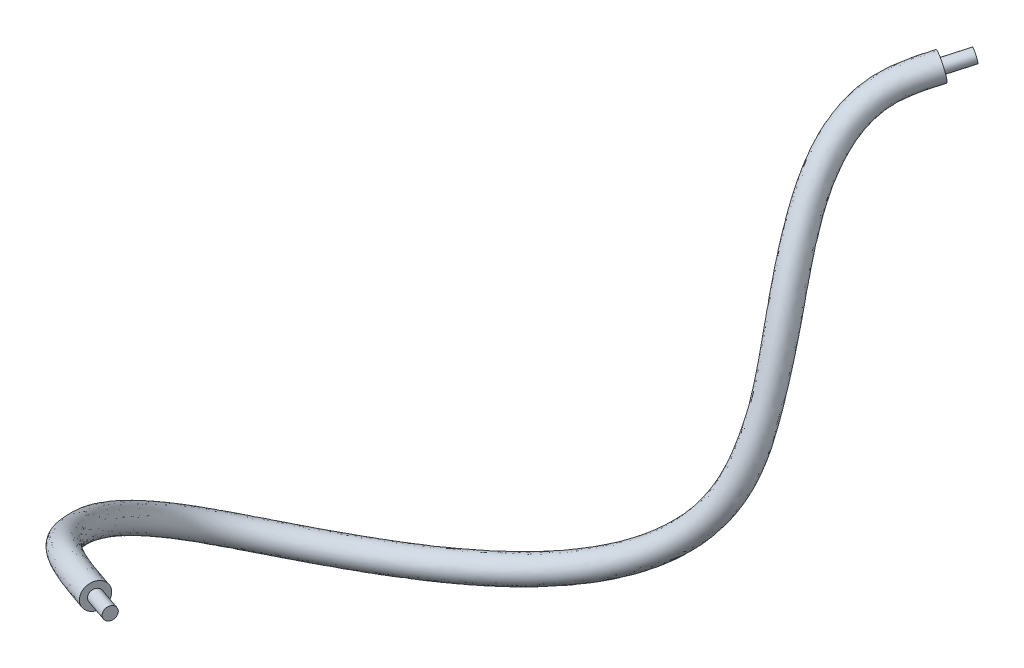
SolidWorks part; units mm, degrees
ref_plane "Plan de face" through (0, 0, 0) normal (0, 0, 1) x (1, 0, 0)
ref_plane "Plan de dessus" through (0, 0, 0) normal (0, 1, 0) x (1, 0, 0)
ref_plane "Plan de droite" through (0, 0, 0) normal (1, 0, 0) x (0, 0, -1)
sketch3d "Esquisse3D1"
  spline S0 degree 3 poles (3.1108, 40.7824, -14.1486) (2.8497, 40.6787, -13.6984) (0.4314, 39.7179, -9.5274) (8.0841, 25.486, -5.9619) (-15.3167, 23.1257, -1.4389) (-9.6844, 29.4174, 7.6973) (-6.8595, 31.7661, 11.1729) (-4.8485, 31.8643, 11.9277) (-4.3569, 31.8883, 12.1122) knots 0 0 0 0 0.034003 0.314998 0.672647 0.860634 0.965934 1 1 1 1
ref_plane "Plan1" through (3.1108, 40.7824, -14.1486) normal (-0.4919, -0.1954, 0.8484) x (0.8706, -0.1104, 0.4794)
sketch "Esquisse1" plane through (3.1108, 40.7824, -14.1486) normal (-0.4919, -0.1954, 0.8484) x (0.8706, -0.1104, 0.4794)
  circle A0 centre (0, 0) radius 0.5
  dimension "D1" = 1
sweep "Balayage1" add profiles "Esquisse1" path "Esquisse3D1"
sketch "Esquisse2" plane through (1.527, 0.0745, 0.5732) normal (0.9352, 0.0456, 0.351) x (0.3506, 0.0171, -0.9364)
  circle A2 centre (-12.3233, 32.0628) radius 0.25
  circle A3 centre (-12.3233, 32.0628) radius 0.25
  dimension "D1" = 0.25
extrude "Extrusion1" add sketch "Esquisse2" along normal blind 1
sketch "Esquisse3" plane through (10.5782, 4.2023, -18.2446) normal (0.4919, 0.1954, -0.8484) x (-0.8706, 0.1104, -0.4794)
  circle A2 centre (8.5769, 36.566) radius 0.25
  circle A3 centre (8.5769, 36.566) radius 0.25
  dimension "D1" = 0.25
extrude "Extrusion2" add sketch "Esquisse3" along normal blind 1
